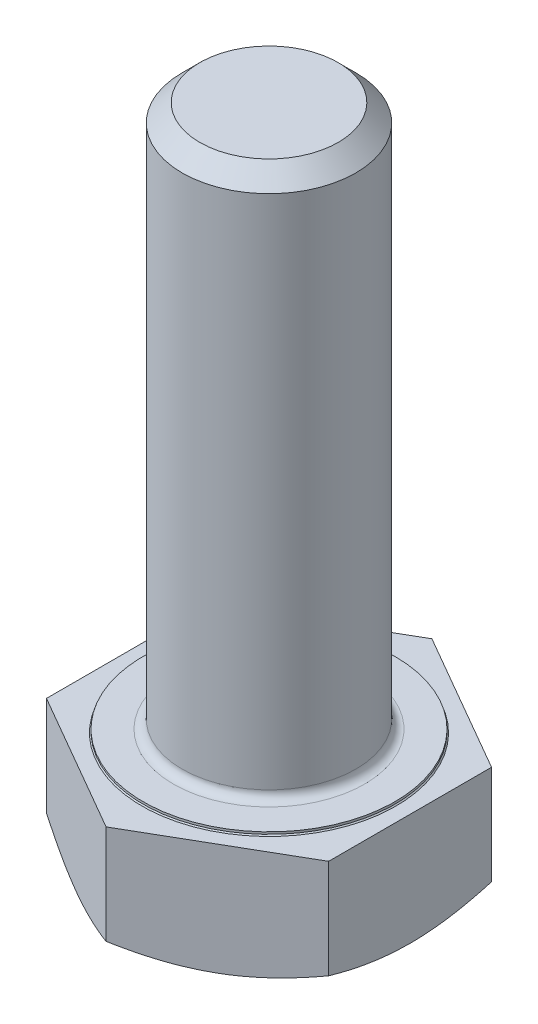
SolidWorks part; units mm, degrees
ref_plane "Plan de face" through (0, 0, 0) normal (0, 0, 1) x (1, 0, 0)
ref_plane "Plan de dessus" through (0, 0, 0) normal (0, 1, 0) x (1, 0, 0)
ref_plane "Plan de droite" through (0, 0, 0) normal (1, 0, 0) x (0, 0, -1)
imported_body "Importée3"
sketch "Esquisse1" plane through (0, -4.7194, 0) normal (0, 1, 0) x (-1, 0, 0)
  line L0 (6.5, 3.7528) -> (6.5, -3.7528)
  line L1 (6.5, -3.7528) -> (0, -7.5056)
  line L2 (0, -7.5056) -> (-6.5, -3.7528)
  line L3 (-6.5, -3.7528) -> (-6.5, 3.7528)
  line L4 (-6.5, 3.7528) -> (0, 7.5056)
  line L5 (0, 7.5056) -> (6.5, 3.7528)
extrude "Boss.-Extru.1" add sketch "Esquisse1" along normal blind 4.5694
sketch "Esquisse2" plane through (0, 0, 0) normal (0, 0, 1) x (1, 0, 0)
  line L0 (4, 25) -> (0, 25)
  line L1 (0, 25) -> (0, -0.15)
  line L2 (0, -0.15) -> (5.8, -0.15)
  line L3 (5.8, -0.15) -> (5.8, 0)
  line L4 (5.8, 0) -> (4, 0)
  line L5 (4, 0) -> (4, 25)
  line L6 (0, 25) -> (0, -0.15) construction
revolve "Révolution1" add sketch "Esquisse2" angle 360 about L6
chamfer "Chanfrein1" distance 0.8119 angle 45 1 edges at (0, 25, -4)
chamfer "Chanfrein2" distance 0.05 angle 45 1 edges at (0, -0.15, -5.8)
fillet "Congé1" radius 0.4 1 edges at (0, 0, -4)
